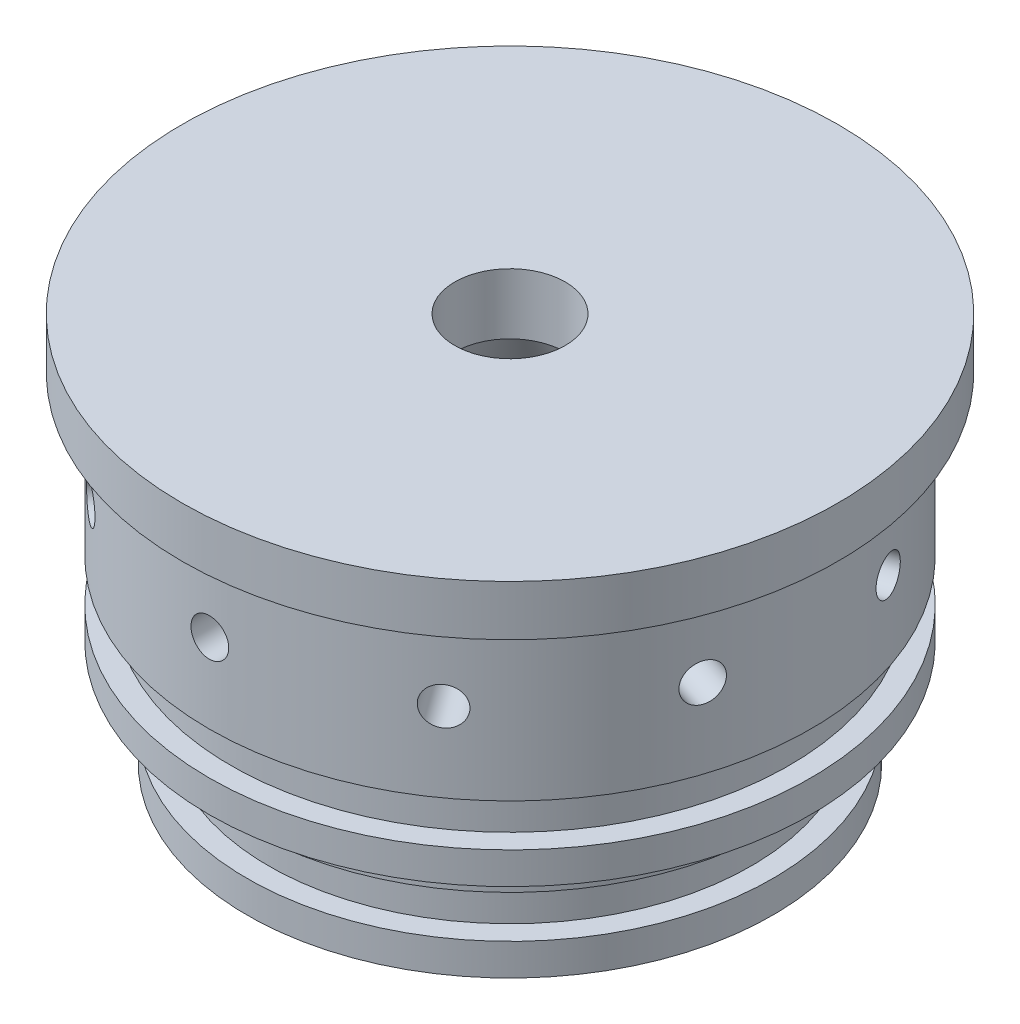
SolidWorks part; units mm, degrees
ref_plane "Front Plane" through (0, 0, 0) normal (0, 0, 1) x (1, 0, 0)
ref_plane "Top Plane" through (0, 0, 0) normal (0, 1, 0) x (1, 0, 0)
ref_plane "Right Plane" through (0, 0, 0) normal (1, 0, 0) x (0, 0, -1)
sketch "Sketch1" plane through (0, 0, 0) normal (0, 0, 1) x (1, 0, 0)
  line L0 (0, 0) -> (0, 39.8554) construction
  line L1 (26.7335, 0) -> (33.0835, 0)
  line L2 (33.0835, 0) -> (33.0835, 4)
  line L3 (33.0835, 13.334) -> (37.846, 13.334)
  line L4 (37.846, 13.334) -> (37.846, 17.334)
  line L5 (37.846, 42.668) -> (41.275, 42.668)
  line L6 (41.275, 42.668) -> (41.275, 49.018)
  line L7 (41.275, 49.018) -> (6.9453, 49.018)
  line L8 (0, 49.018) -> (0, 39.8554)
  line L9 (33.0835, 0) -> (33.0835, 4)
  line L10 (33.0835, 4) -> (30.3657, 4)
  line L11 (30.3657, 4) -> (30.3657, 9.334)
  line L12 (30.3657, 9.334) -> (33.0835, 9.334)
  line L13 (33.0835, 9.334) -> (33.0835, 13.334)
  line L14 (37.846, 13.334) -> (37.846, 17.334)
  line L15 (37.846, 17.334) -> (35.1282, 17.334)
  line L16 (35.1282, 17.334) -> (35.1282, 22.668)
  line L17 (35.1282, 22.668) -> (37.846, 22.668)
  line L18 (37.846, 22.668) -> (37.846, 42.668)
  line L19 (33.0835, 0) -> (26.7335, 0)
  line L20 (26.7335, 0) -> (26.7335, 12.7)
  line L22 (26.7335, 12.7) -> (20.3835, 12.7)
  line L24 (6.9453, 49.018) -> (6.9453, 41.3753)
  line L25 (6.9453, 41.3753) -> (20.3835, 12.7)
  dimension "D1" = 33.0835
  dimension "D2" = 41.275
  dimension "D3" = 20
  dimension "D4" = 3.429
  dimension "D5" = 5.334
  dimension "D6" = 4
  dimension "D7" = 4
  dimension "D8" = 4
  dimension "D9" = 5.334
  dimension "D10" = 2.7178
  dimension "D11" = 2.7178
  dimension "D12" = 6.35
  dimension "D13" = 6.35
  dimension "D14" = 12.7
  dimension "D15" = 6.9453
revolve "Revolve1" add sketch "Sketch1" angle 360 about L0
sketch "Sketch2" plane through (0, 0, 0) normal (0, 0, 1) x (1, 0, 0)
  line L0 (0, 0) -> (0, 22.668)
  line L1 (-33.0835, 0) -> (33.0835, 0) construction
  line L2 (-35.1282, 22.668) -> (35.1282, 22.668) construction
  line L3 (0, 22.668) -> (0, 42.668)
  line L4 (-37.846, 42.668) -> (37.846, 42.668) construction
  circle A0 centre (0, 32.668) radius 2.3812
  point P11 (0, 30.2867)
  dimension "D1" = 4.7625
ref_plane "Plane1" through (0, 0, 37.846) normal (0, 0, 1) x (1, 0, 0)
sketch "Sketch3" plane through (0, 0, 37.846) normal (0, 0, 1) x (1, 0, 0)
  circle A0 centre (0, 32.668) radius 2.3749
  dimension "D1" = 4.7498
extrude "Cut-Extrude2" cut sketch "Sketch3" against normal blind 12.7
pattern_circular "CirPattern1" count 10 over 360 about axis through (0, 0, 0) along (0, 1, 0) of "Cut-Extrude2"
